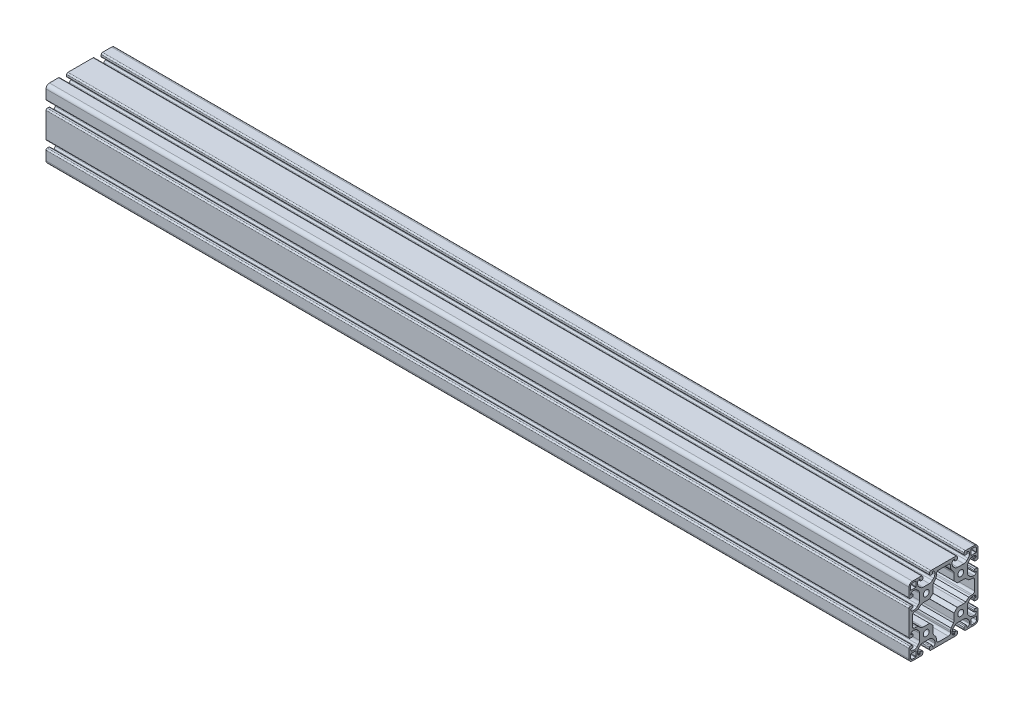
SolidWorks part; units mm, degrees
ref_plane "Ebene vorne" through (0, 0, 0) normal (0, 0, 1) x (1, 0, 0)
ref_plane "Ebene oben" through (0, 0, 0) normal (0, 1, 0) x (1, 0, 0)
ref_plane "Ebene rechts" through (0, 0, 0) normal (1, 0, 0) x (0, 0, -1)
sketch "Skizze1" plane through (0, 0, 0) normal (0, 1, 0) x (1, 0, 0)
  line L0 (0, 0) -> (1000, 0)
  dimension "D1" = 1000
other "Strukturbauteil1"
ref_plane "Ebene1" through (0, 0, 0) normal (1, 0, 0) x (0, 0, -1)
sketch "Model" plane through (0, 0, 0) normal (1, 0, 0) x (0, 0, -1)
  line L0 (-27.5, 38) -> (-27.1464, 37.8536)
  line L1 (-27.1464, 37.8536) -> (-27, 37.5)
  line L2 (-13, 37.5) -> (-12.8536, 37.8536)
  line L3 (-12.8536, 37.8536) -> (-12.5, 38)
  line L4 (-10.225, 27.5762) -> (-11.7151, 25.8076)
  line L6 (-11.7151, 25.8076) -> (-12.25, 23.5576)
  line L7 (-23.5576, 12.25) -> (-25.8076, 11.7151)
  line L8 (-38.2, 36) -> (-38.2, 32.3)
  line L9 (-37.7, 31.8) -> (-32.3, 31.8)
  line L10 (-31.8, 32.3) -> (-31.8, 37.7)
  line L11 (-32.3, 38.2) -> (-36, 38.2)
  line L12 (-25.8076, 11.7151) -> (-27.5762, 10.225)
  line L13 (-27.5762, 10.225) -> (-29.3449, 8.7349)
  line L14 (-29.3449, 8.7349) -> (-31.5949, 8.2)
  line L15 (-10.225, 27.5762) -> (-8.7349, 29.3449)
  line L16 (-8.7349, 29.3449) -> (-8.2, 31.5949)
  line L17 (-37.5, 13) -> (-37.8536, 12.8536)
  line L18 (-37.8536, 12.8536) -> (-38, 12.5)
  line L19 (-38, 27.5) -> (-37.8536, 27.1464)
  line L20 (-37.8536, 27.1464) -> (-37.5, 27)
  line L21 (-40, -40) -> (40, -40) construction
  line L22 (38, 27.5) -> (37.8536, 27.1464)
  line L23 (37.8536, 27.1464) -> (37.5, 27)
  line L24 (37.5, 13) -> (37.8536, 12.8536)
  line L25 (37.8536, 12.8536) -> (38, 12.5)
  line L26 (27.5762, 10.225) -> (25.8076, 11.7151)
  line L27 (25.8076, 11.7151) -> (23.5576, 12.25)
  line L28 (12.25, 23.5576) -> (11.7151, 25.8076)
  line L29 (36, 38.2) -> (32.3, 38.2)
  line L30 (31.8, 37.7) -> (31.8, 32.3)
  line L31 (32.3, 31.8) -> (37.7, 31.8)
  line L32 (38.2, 32.3) -> (38.2, 36)
  line L33 (11.7151, 25.8076) -> (10.225, 27.5762)
  line L34 (10.225, 27.5762) -> (8.7349, 29.3449)
  line L35 (8.7349, 29.3449) -> (8.2, 31.5949)
  line L36 (27.5762, 10.225) -> (29.3449, 8.7349)
  line L37 (29.3449, 8.7349) -> (31.5949, 8.2)
  line L38 (13, 37.5) -> (12.8536, 37.8536)
  line L39 (12.8536, 37.8536) -> (12.5, 38)
  line L40 (27.5, 38) -> (27.1464, 37.8536)
  line L41 (27.1464, 37.8536) -> (27, 37.5)
  line L42 (40, -14.5) -> (40, 14.5)
  line L43 (38.5, 16) -> (36.5, 16)
  line L44 (35.5, 15) -> (35.5, 13.5)
  line L45 (36, 13) -> (37.5, 13)
  line L46 (35.5, 10) -> (34.1924, 10)
  line L47 (30.6569, 11.4645) -> (29.2145, 12.9069)
  line L48 (27.75, 16.4424) -> (27.75, 23.5576)
  line L49 (29.2145, 27.0931) -> (30.6569, 28.5355)
  line L50 (34.1924, 30) -> (35.5, 30)
  line L51 (37.5, 27) -> (36, 27)
  line L52 (35.5, 26.5) -> (35.5, 25)
  line L53 (36.5, 24) -> (38.5, 24)
  line L54 (40, 25.5) -> (40, 36)
  line L55 (36, 40) -> (25.5, 40)
  line L56 (24, 38.5) -> (24, 36.5)
  line L57 (25, 35.5) -> (26.5, 35.5)
  line L58 (27, 36) -> (27, 37.5)
  line L59 (30, 35.5) -> (30, 34.1924)
  line L60 (28.5355, 30.6569) -> (27.0931, 29.2145)
  line L61 (23.5576, 27.75) -> (16.4424, 27.75)
  line L62 (12.9069, 29.2145) -> (11.4645, 30.6569)
  line L63 (10, 34.1924) -> (10, 35.5)
  line L64 (13, 37.5) -> (13, 36)
  line L65 (13.5, 35.5) -> (15, 35.5)
  line L66 (16, 36.5) -> (16, 38.5)
  line L67 (14.5, 40) -> (-14.5, 40)
  line L68 (36, 0) -> (36, 5.7)
  line L69 (33.5, 8.2) -> (31.5949, 8.2)
  line L70 (23.5576, 12.25) -> (16.1171, 12.25)
  line L71 (15.9757, 12.3086) -> (12.3086, 15.9757)
  line L72 (12.25, 16.1171) -> (12.25, 23.5576)
  line L73 (8.2, 31.5949) -> (8.2, 33.5)
  line L74 (-40, 14.5) -> (-40, -14.5)
  line L75 (-16, 38.5) -> (-16, 36.5)
  line L76 (-15, 35.5) -> (-13.5, 35.5)
  line L77 (-13, 36) -> (-13, 37.5)
  line L78 (-10, 35.5) -> (-10, 34.1924)
  line L79 (-11.4645, 30.6569) -> (-12.9069, 29.2145)
  line L80 (-16.4424, 27.75) -> (-23.5576, 27.75)
  line L81 (-27.0931, 29.2145) -> (-28.5355, 30.6569)
  line L82 (-30, 34.1924) -> (-30, 35.5)
  line L83 (-27, 37.5) -> (-27, 36)
  line L84 (-26.5, 35.5) -> (-25, 35.5)
  line L85 (-24, 36.5) -> (-24, 38.5)
  line L86 (-25.5, 40) -> (-36, 40)
  line L87 (-40, 36) -> (-40, 25.5)
  line L88 (-38.5, 24) -> (-36.5, 24)
  line L89 (-35.5, 25) -> (-35.5, 26.5)
  line L90 (-36, 27) -> (-37.5, 27)
  line L91 (-35.5, 30) -> (-34.1924, 30)
  line L92 (-30.6569, 28.5355) -> (-29.2145, 27.0931)
  line L93 (-27.75, 23.5576) -> (-27.75, 16.4424)
  line L94 (-29.2145, 12.9069) -> (-30.6569, 11.4645)
  line L95 (-34.1924, 10) -> (-35.5, 10)
  line L96 (-37.5, 13) -> (-36, 13)
  line L97 (-35.5, 13.5) -> (-35.5, 15)
  line L98 (-36.5, 16) -> (-38.5, 16)
  line L99 (-14.5, -40) -> (14.5, -40)
  line L100 (5.7, 36) -> (0, 36)
  line L101 (-40, -40) -> (-40, 40) construction
  line L102 (-40, 40) -> (40, 40) construction
  line L103 (27.5, -38) -> (27.1464, -37.8536)
  line L104 (27.1464, -37.8536) -> (27, -37.5)
  line L105 (13, -37.5) -> (12.8536, -37.8536)
  line L106 (12.8536, -37.8536) -> (12.5, -38)
  line L107 (10.225, -27.5762) -> (11.7151, -25.8076)
  line L108 (11.7151, -25.8076) -> (12.25, -23.5576)
  line L109 (23.5576, -12.25) -> (25.8076, -11.7151)
  line L110 (38.2, -36) -> (38.2, -32.3)
  line L111 (37.7, -31.8) -> (32.3, -31.8)
  line L112 (31.8, -32.3) -> (31.8, -37.7)
  line L113 (32.3, -38.2) -> (36, -38.2)
  line L114 (25.8076, -11.7151) -> (27.5762, -10.225)
  line L115 (27.5762, -10.225) -> (29.3449, -8.7349)
  line L116 (29.3449, -8.7349) -> (31.5949, -8.2)
  line L117 (10.225, -27.5762) -> (8.7349, -29.3449)
  line L118 (8.7349, -29.3449) -> (8.2, -31.5949)
  line L119 (37.5, -13) -> (37.8536, -12.8536)
  line L120 (37.8536, -12.8536) -> (38, -12.5)
  line L121 (38, -27.5) -> (37.8536, -27.1464)
  line L122 (37.8536, -27.1464) -> (37.5, -27)
  line L123 (40, -40) -> (40, 40) construction
  line L124 (16, -38.5) -> (16, -36.5)
  line L125 (15, -35.5) -> (13.5, -35.5)
  line L126 (13, -36) -> (13, -37.5)
  line L127 (10, -35.5) -> (10, -34.1924)
  line L128 (11.4645, -30.6569) -> (12.9069, -29.2145)
  line L129 (16.4424, -27.75) -> (23.5576, -27.75)
  line L130 (27.0931, -29.2145) -> (28.5355, -30.6569)
  line L131 (30, -34.1924) -> (30, -35.5)
  line L132 (27, -37.5) -> (27, -36)
  line L133 (0, 36) -> (-5.7, 36)
  line L134 (-8.2, 33.5) -> (-8.2, 31.5949)
  line L135 (-12.25, 23.5576) -> (-12.25, 16.1171)
  line L136 (-12.3086, 15.9757) -> (-15.9757, 12.3086)
  line L137 (-16.1171, 12.25) -> (-23.5576, 12.25)
  line L138 (-31.5949, 8.2) -> (-33.5, 8.2)
  line L139 (-36, 5.7) -> (-36, 0)
  line L140 (26.5, -35.5) -> (25, -35.5)
  line L141 (24, -36.5) -> (24, -38.5)
  line L142 (25.5, -40) -> (36, -40)
  line L143 (40, -36) -> (40, -25.5)
  line L144 (38.5, -24) -> (36.5, -24)
  line L145 (35.5, -25) -> (35.5, -26.5)
  line L146 (36, -27) -> (37.5, -27)
  line L147 (35.5, -30) -> (34.1924, -30)
  line L148 (30.6569, -28.5355) -> (29.2145, -27.0931)
  line L149 (27.75, -23.5576) -> (27.75, -16.4424)
  line L150 (29.2145, -12.9069) -> (30.6569, -11.4645)
  line L151 (34.1924, -10) -> (35.5, -10)
  line L152 (37.5, -13) -> (36, -13)
  line L153 (35.5, -13.5) -> (35.5, -15)
  line L154 (36.5, -16) -> (38.5, -16)
  line L155 (-40, -40) -> (40, 40) construction
  line L156 (0, -36) -> (5.7, -36)
  line L157 (8.2, -33.5) -> (8.2, -31.5949)
  line L158 (12.25, -23.5576) -> (12.25, -16.1171)
  line L159 (12.3086, -15.9757) -> (15.9757, -12.3086)
  line L160 (16.1171, -12.25) -> (23.5576, -12.25)
  line L161 (31.5949, -8.2) -> (33.5, -8.2)
  line L162 (36, -5.7) -> (36, 0)
  line L163 (-40, 40) -> (40, -40) construction
  line L165 (-38, -27.5) -> (-37.8536, -27.1464)
  line L166 (-37.8536, -27.1464) -> (-37.5, -27)
  line L167 (-37.5, -13) -> (-37.8536, -12.8536)
  line L168 (-37.8536, -12.8536) -> (-38, -12.5)
  line L169 (-27.5762, -10.225) -> (-25.8076, -11.7151)
  line L170 (-25.8076, -11.7151) -> (-23.5576, -12.25)
  line L171 (-12.25, -23.5576) -> (-11.7151, -25.8076)
  line L172 (-36, -38.2) -> (-32.3, -38.2)
  line L173 (-31.8, -37.7) -> (-31.8, -32.3)
  line L174 (-32.3, -31.8) -> (-37.7, -31.8)
  line L175 (-38.2, -32.3) -> (-38.2, -36)
  line L176 (-11.7151, -25.8076) -> (-10.225, -27.5762)
  line L177 (-10.225, -27.5762) -> (-8.7349, -29.3449)
  line L178 (-8.7349, -29.3449) -> (-8.2, -31.5949)
  line L179 (-27.5762, -10.225) -> (-29.3449, -8.7349)
  line L180 (-29.3449, -8.7349) -> (-31.5949, -8.2)
  line L181 (-13, -37.5) -> (-12.8536, -37.8536)
  line L182 (-12.8536, -37.8536) -> (-12.5, -38)
  line L183 (-27.5, -38) -> (-27.1464, -37.8536)
  line L184 (-27.1464, -37.8536) -> (-27, -37.5)
  line L186 (-38.5, -16) -> (-36.5, -16)
  line L187 (-35.5, -15) -> (-35.5, -13.5)
  line L188 (-36, -13) -> (-37.5, -13)
  line L189 (-35.5, -10) -> (-34.1924, -10)
  line L190 (-30.6569, -11.4645) -> (-29.2145, -12.9069)
  line L191 (-27.75, -16.4424) -> (-27.75, -23.5576)
  line L192 (-29.2145, -27.0931) -> (-30.6569, -28.5355)
  line L193 (-34.1924, -30) -> (-35.5, -30)
  line L194 (-37.5, -27) -> (-36, -27)
  line L195 (-35.5, -26.5) -> (-35.5, -25)
  line L196 (-36.5, -24) -> (-38.5, -24)
  line L197 (-40, -25.5) -> (-40, -36)
  line L198 (-36, -40) -> (-25.5, -40)
  line L199 (-24, -38.5) -> (-24, -36.5)
  line L200 (-25, -35.5) -> (-26.5, -35.5)
  line L201 (-27, -36) -> (-27, -37.5)
  line L202 (-30, -35.5) -> (-30, -34.1924)
  line L203 (-28.5355, -30.6569) -> (-27.0931, -29.2145)
  line L204 (-23.5576, -27.75) -> (-16.4424, -27.75)
  line L205 (-12.9069, -29.2145) -> (-11.4645, -30.6569)
  line L206 (-10, -34.1924) -> (-10, -35.5)
  line L207 (-13, -37.5) -> (-13, -36)
  line L208 (-13.5, -35.5) -> (-15, -35.5)
  line L209 (-16, -36.5) -> (-16, -38.5)
  line L211 (-36, 0) -> (-36, -5.7)
  line L212 (-33.5, -8.2) -> (-31.5949, -8.2)
  line L213 (-23.5576, -12.25) -> (-16.1171, -12.25)
  line L214 (-15.9757, -12.3086) -> (-12.3086, -15.9757)
  line L215 (-12.25, -16.1171) -> (-12.25, -23.5576)
  line L216 (-8.2, -31.5949) -> (-8.2, -33.5)
  line L217 (-5.7, -36) -> (0, -36)
  circle A0 centre (20, 20) radius 3.4
  arc A1 (38.2, 36) -> (36, 38.2) centre (36, 36) ccw
  circle A2 centre (-20, 20) radius 3.4
  arc A3 (32.3, 38.2) -> (31.8, 37.7) centre (32.3, 37.7) ccw
  arc A4 (31.8, 32.3) -> (32.3, 31.8) centre (32.3, 32.3) ccw
  arc A5 (37.7, 31.8) -> (38.2, 32.3) centre (37.7, 32.3) ccw
  arc A6 (40, 14.5) -> (38.5, 16) centre (38.5, 14.5) ccw
  arc A7 (36.5, 16) -> (35.5, 15) centre (36.5, 15) ccw
  arc A8 (35.5, 13.5) -> (36, 13) centre (36, 13.5) ccw
  arc A9 (35.5, 10) -> (38, 12.5) centre (35.5, 12.5) ccw
  arc A10 (30.6569, 11.4645) -> (34.1924, 10) centre (34.1924, 15) ccw
  arc A11 (27.75, 16.4424) -> (29.2145, 12.9069) centre (32.75, 16.4424) ccw
  arc A12 (-36, 38.2) -> (-38.2, 36) centre (-36, 36) ccw
  arc A13 (-38.2, 32.3) -> (-37.7, 31.8) centre (-37.7, 32.3) ccw
  arc A14 (-32.3, 31.8) -> (-31.8, 32.3) centre (-32.3, 32.3) ccw
  arc A15 (-31.8, 37.7) -> (-32.3, 38.2) centre (-32.3, 37.7) ccw
  arc A16 (29.2145, 27.0931) -> (27.75, 23.5576) centre (32.75, 23.5576) ccw
  arc A17 (34.1924, 30) -> (30.6569, 28.5355) centre (34.1924, 25) ccw
  arc A18 (38, 27.5) -> (35.5, 30) centre (35.5, 27.5) ccw
  arc A19 (36, 27) -> (35.5, 26.5) centre (36, 26.5) ccw
  arc A20 (35.5, 25) -> (36.5, 24) centre (36.5, 25) ccw
  arc A21 (38.5, 24) -> (40, 25.5) centre (38.5, 25.5) ccw
  arc A22 (40, 36) -> (36, 40) centre (36, 36) ccw
  arc A23 (25.5, 40) -> (24, 38.5) centre (25.5, 38.5) ccw
  arc A24 (24, 36.5) -> (25, 35.5) centre (25, 36.5) ccw
  arc A25 (26.5, 35.5) -> (27, 36) centre (26.5, 36) ccw
  arc A26 (30, 35.5) -> (27.5, 38) centre (27.5, 35.5) ccw
  arc A27 (28.5355, 30.6569) -> (30, 34.1924) centre (25, 34.1924) ccw
  arc A28 (23.5576, 27.75) -> (27.0931, 29.2145) centre (23.5576, 32.75) ccw
  arc A29 (12.9069, 29.2145) -> (16.4424, 27.75) centre (16.4424, 32.75) ccw
  arc A30 (10, 34.1924) -> (11.4645, 30.6569) centre (15, 34.1924) ccw
  arc A31 (12.5, 38) -> (10, 35.5) centre (12.5, 35.5) ccw
  arc A32 (13, 36) -> (13.5, 35.5) centre (13.5, 36) ccw
  arc A33 (15, 35.5) -> (16, 36.5) centre (15, 36.5) ccw
  arc A34 (16, 38.5) -> (14.5, 40) centre (14.5, 38.5) ccw
  arc A35 (36, 5.7) -> (33.5, 8.2) centre (33.5, 5.7) ccw
  arc A36 (15.9757, 12.3086) -> (16.1171, 12.25) centre (16.1171, 12.45) ccw
  arc A37 (12.25, 16.1171) -> (12.3086, 15.9757) centre (12.45, 16.1171) ccw
  arc A38 (8.2, 33.5) -> (5.7, 36) centre (5.7, 33.5) ccw
  circle A39 centre (20, -20) radius 3.4
  arc A40 (36, -38.2) -> (38.2, -36) centre (36, -36) ccw
  arc A41 (38.2, -32.3) -> (37.7, -31.8) centre (37.7, -32.3) ccw
  arc A42 (32.3, -31.8) -> (31.8, -32.3) centre (32.3, -32.3) ccw
  arc A43 (31.8, -37.7) -> (32.3, -38.2) centre (32.3, -37.7) ccw
  arc A44 (14.5, -40) -> (16, -38.5) centre (14.5, -38.5) ccw
  arc A45 (16, -36.5) -> (15, -35.5) centre (15, -36.5) ccw
  arc A46 (13.5, -35.5) -> (13, -36) centre (13.5, -36) ccw
  arc A47 (10, -35.5) -> (12.5, -38) centre (12.5, -35.5) ccw
  arc A48 (11.4645, -30.6569) -> (10, -34.1924) centre (15, -34.1924) ccw
  arc A49 (16.4424, -27.75) -> (12.9069, -29.2145) centre (16.4424, -32.75) ccw
  arc A50 (27.0931, -29.2145) -> (23.5576, -27.75) centre (23.5576, -32.75) ccw
  arc A51 (30, -34.1924) -> (28.5355, -30.6569) centre (25, -34.1924) ccw
  arc A52 (27.5, -38) -> (30, -35.5) centre (27.5, -35.5) ccw
  arc A53 (27, -36) -> (26.5, -35.5) centre (26.5, -36) ccw
  arc A54 (25, -35.5) -> (24, -36.5) centre (25, -36.5) ccw
  arc A55 (24, -38.5) -> (25.5, -40) centre (25.5, -38.5) ccw
  arc A56 (36, -40) -> (40, -36) centre (36, -36) ccw
  arc A57 (40, -25.5) -> (38.5, -24) centre (38.5, -25.5) ccw
  arc A58 (36.5, -24) -> (35.5, -25) centre (36.5, -25) ccw
  arc A59 (35.5, -26.5) -> (36, -27) centre (36, -26.5) ccw
  arc A60 (35.5, -30) -> (38, -27.5) centre (35.5, -27.5) ccw
  arc A61 (30.6569, -28.5355) -> (34.1924, -30) centre (34.1924, -25) ccw
  arc A62 (27.75, -23.5576) -> (29.2145, -27.0931) centre (32.75, -23.5576) ccw
  arc A63 (29.2145, -12.9069) -> (27.75, -16.4424) centre (32.75, -16.4424) ccw
  arc A64 (34.1924, -10) -> (30.6569, -11.4645) centre (34.1924, -15) ccw
  arc A65 (38, -12.5) -> (35.5, -10) centre (35.5, -12.5) ccw
  arc A66 (36, -13) -> (35.5, -13.5) centre (36, -13.5) ccw
  arc A67 (35.5, -15) -> (36.5, -16) centre (36.5, -15) ccw
  arc A68 (38.5, -16) -> (40, -14.5) centre (38.5, -14.5) ccw
  arc A69 (5.7, -36) -> (8.2, -33.5) centre (5.7, -33.5) ccw
  arc A70 (12.3086, -15.9757) -> (12.25, -16.1171) centre (12.45, -16.1171) ccw
  arc A71 (16.1171, -12.25) -> (15.9757, -12.3086) centre (16.1171, -12.45) ccw
  arc A72 (33.5, -8.2) -> (36, -5.7) centre (33.5, -5.7) ccw
  circle A73 centre (-20, -20) radius 3.4
  arc A74 (-38.2, -36) -> (-36, -38.2) centre (-36, -36) ccw
  arc A75 (-32.3, -38.2) -> (-31.8, -37.7) centre (-32.3, -37.7) ccw
  arc A76 (-31.8, -32.3) -> (-32.3, -31.8) centre (-32.3, -32.3) ccw
  arc A77 (-37.7, -31.8) -> (-38.2, -32.3) centre (-37.7, -32.3) ccw
  arc A78 (-40, -14.5) -> (-38.5, -16) centre (-38.5, -14.5) ccw
  arc A79 (-36.5, -16) -> (-35.5, -15) centre (-36.5, -15) ccw
  arc A80 (-35.5, -13.5) -> (-36, -13) centre (-36, -13.5) ccw
  arc A81 (-35.5, -10) -> (-38, -12.5) centre (-35.5, -12.5) ccw
  arc A82 (-30.6569, -11.4645) -> (-34.1924, -10) centre (-34.1924, -15) ccw
  arc A83 (-27.75, -16.4424) -> (-29.2145, -12.9069) centre (-32.75, -16.4424) ccw
  arc A84 (-29.2145, -27.0931) -> (-27.75, -23.5576) centre (-32.75, -23.5576) ccw
  arc A85 (-34.1924, -30) -> (-30.6569, -28.5355) centre (-34.1924, -25) ccw
  arc A86 (-38, -27.5) -> (-35.5, -30) centre (-35.5, -27.5) ccw
  arc A87 (-36, -27) -> (-35.5, -26.5) centre (-36, -26.5) ccw
  arc A88 (-14.5, 40) -> (-16, 38.5) centre (-14.5, 38.5) ccw
  arc A89 (-16, 36.5) -> (-15, 35.5) centre (-15, 36.5) ccw
  arc A90 (-13.5, 35.5) -> (-13, 36) centre (-13.5, 36) ccw
  arc A91 (-35.5, -25) -> (-36.5, -24) centre (-36.5, -25) ccw
  arc A92 (-10, 35.5) -> (-12.5, 38) centre (-12.5, 35.5) ccw
  arc A93 (-11.4645, 30.6569) -> (-10, 34.1924) centre (-15, 34.1924) ccw
  arc A94 (-16.4424, 27.75) -> (-12.9069, 29.2145) centre (-16.4424, 32.75) ccw
  arc A95 (-27.0931, 29.2145) -> (-23.5576, 27.75) centre (-23.5576, 32.75) ccw
  arc A96 (-30, 34.1924) -> (-28.5355, 30.6569) centre (-25, 34.1924) ccw
  arc A97 (-27.5, 38) -> (-30, 35.5) centre (-27.5, 35.5) ccw
  arc A98 (-38.5, -24) -> (-40, -25.5) centre (-38.5, -25.5) ccw
  arc A99 (-27, 36) -> (-26.5, 35.5) centre (-26.5, 36) ccw
  arc A100 (-25, 35.5) -> (-24, 36.5) centre (-25, 36.5) ccw
  arc A101 (-24, 38.5) -> (-25.5, 40) centre (-25.5, 38.5) ccw
  arc A102 (-36, 40) -> (-40, 36) centre (-36, 36) ccw
  arc A103 (-40, 25.5) -> (-38.5, 24) centre (-38.5, 25.5) ccw
  arc A104 (-36.5, 24) -> (-35.5, 25) centre (-36.5, 25) ccw
  arc A105 (-35.5, 26.5) -> (-36, 27) centre (-36, 26.5) ccw
  arc A106 (-40, -36) -> (-36, -40) centre (-36, -36) ccw
  arc A107 (-35.5, 30) -> (-38, 27.5) centre (-35.5, 27.5) ccw
  arc A108 (-30.6569, 28.5355) -> (-34.1924, 30) centre (-34.1924, 25) ccw
  arc A109 (-27.75, 23.5576) -> (-29.2145, 27.0931) centre (-32.75, 23.5576) ccw
  arc A110 (-29.2145, 12.9069) -> (-27.75, 16.4424) centre (-32.75, 16.4424) ccw
  arc A111 (-34.1924, 10) -> (-30.6569, 11.4645) centre (-34.1924, 15) ccw
  arc A112 (-38, 12.5) -> (-35.5, 10) centre (-35.5, 12.5) ccw
  arc A113 (-25.5, -40) -> (-24, -38.5) centre (-25.5, -38.5) ccw
  arc A114 (-36, 13) -> (-35.5, 13.5) centre (-36, 13.5) ccw
  arc A115 (-35.5, 15) -> (-36.5, 16) centre (-36.5, 15) ccw
  arc A116 (-38.5, 16) -> (-40, 14.5) centre (-38.5, 14.5) ccw
  arc A117 (-24, -36.5) -> (-25, -35.5) centre (-25, -36.5) ccw
  arc A118 (-26.5, -35.5) -> (-27, -36) centre (-26.5, -36) ccw
  arc A119 (-30, -35.5) -> (-27.5, -38) centre (-27.5, -35.5) ccw
  arc A120 (-28.5355, -30.6569) -> (-30, -34.1924) centre (-25, -34.1924) ccw
  arc A121 (-23.5576, -27.75) -> (-27.0931, -29.2145) centre (-23.5576, -32.75) ccw
  arc A122 (-12.9069, -29.2145) -> (-16.4424, -27.75) centre (-16.4424, -32.75) ccw
  arc A123 (-10, -34.1924) -> (-11.4645, -30.6569) centre (-15, -34.1924) ccw
  arc A124 (-12.5, -38) -> (-10, -35.5) centre (-12.5, -35.5) ccw
  arc A125 (-13, -36) -> (-13.5, -35.5) centre (-13.5, -36) ccw
  arc A126 (-15, -35.5) -> (-16, -36.5) centre (-15, -36.5) ccw
  arc A127 (-16, -38.5) -> (-14.5, -40) centre (-14.5, -38.5) ccw
  arc A128 (-36, -5.7) -> (-33.5, -8.2) centre (-33.5, -5.7) ccw
  arc A129 (-15.9757, -12.3086) -> (-16.1171, -12.25) centre (-16.1171, -12.45) ccw
  arc A130 (-12.25, -16.1171) -> (-12.3086, -15.9757) centre (-12.45, -16.1171) ccw
  arc A131 (-8.2, -33.5) -> (-5.7, -36) centre (-5.7, -33.5) ccw
  arc A159 (-5.7, 36) -> (-8.2, 33.5) centre (-5.7, 33.5) ccw
  arc A162 (-12.3086, 15.9757) -> (-12.25, 16.1171) centre (-12.45, 16.1171) ccw
  arc A163 (-16.1171, 12.25) -> (-15.9757, 12.3086) centre (-16.1171, 12.45) ccw
  arc A166 (-33.5, 8.2) -> (-36, 5.7) centre (-33.5, 5.7) ccw
  point P0 (40, -20)
  point P1 (40, 20)
  point P2 (-40, -20)
  point P3 (20, -40)
  point P6 (7.2458, 40)
  point P15 (40, -7.2458)
  point P16 (-7.2458, -40)
  point P17 (0, 0)
  point P152 (40, 0)
  point P155 (0, 0)
  point P357 (0, -40)
  point P478 (0, 40)
  point P507 (-40, 0)
  point P511 (0, 0)
  dimension "D1" = 4
